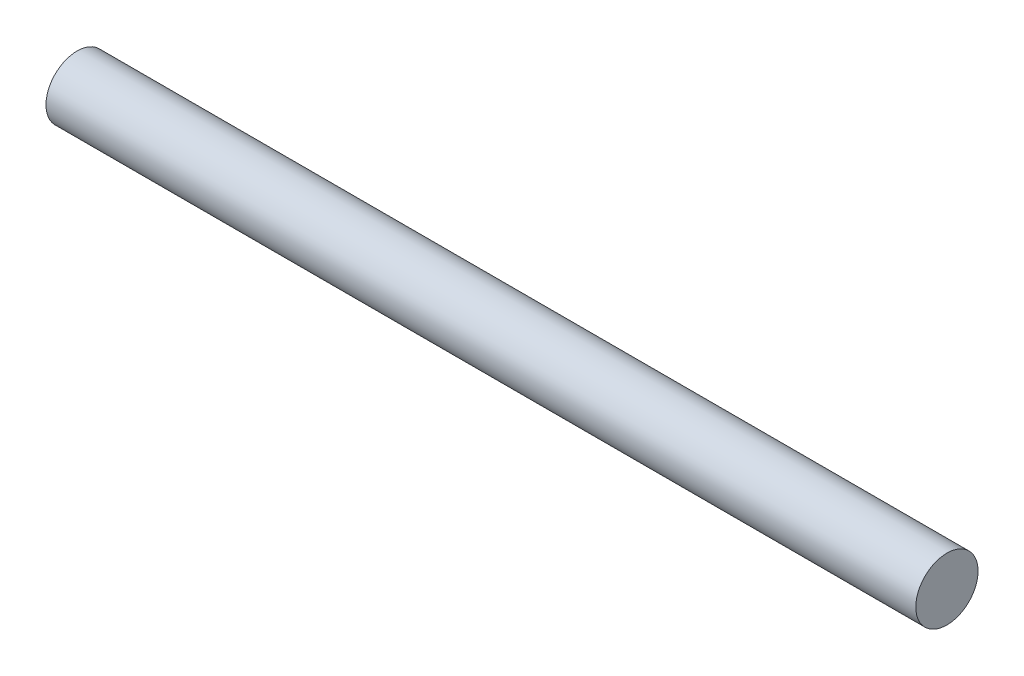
SolidWorks part; units mm, degrees
ref_plane "Plan de face" through (0, 0, 0) normal (0, 0, 1) x (1, 0, 0)
ref_plane "Plan de dessus" through (0, 0, 0) normal (0, 1, 0) x (1, 0, 0)
ref_plane "Plan de droite" through (0, 0, 0) normal (1, 0, 0) x (0, 0, -1)
sketch "Esquisse1" plane through (0, 0, 0) normal (0, 0, 1) x (1, 0, 0)
  line L0 (37.4845, 0.8602) -> (59.0328, 0.8602) construction
  line L2 (37.7441, 0.3157) -> (52.9487, 0.3157)
  line L3 (37.7441, 0.3157) -> (37.7441, 0.8602)
  line L4 (37.7441, 0.8602) -> (52.9487, 0.8602)
  line L5 (52.9487, 0.3157) -> (52.9487, 0.8602)
revolve "Révolution1" add sketch "Esquisse1" angle 360 about L0
sketch "Esquisse2" plane through (37.7441, 0, 0) normal (-1, 0, 0) x (0, 0, 1)
  point P0 (0, 0.8602)
